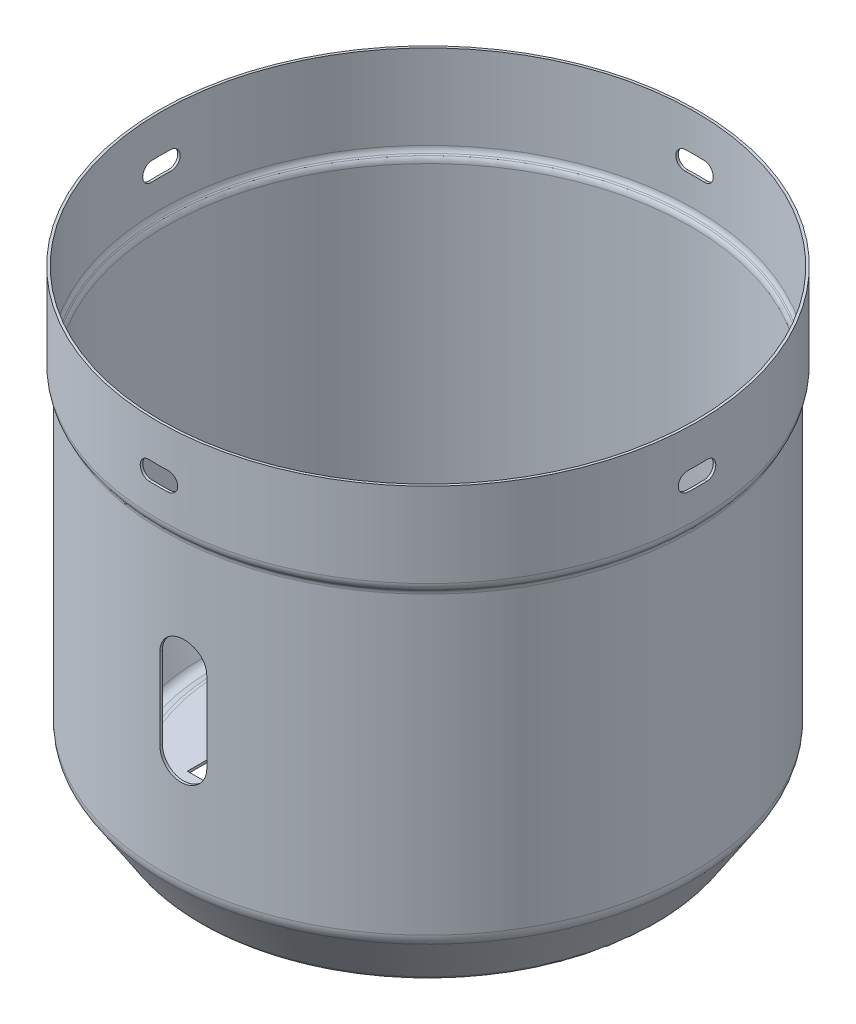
SolidWorks part; units mm, degrees
ref_plane "前视基准面" through (0, 0, 0) normal (0, 0, 1) x (1, 0, 0)
ref_plane "上视基准面" through (0, 0, 0) normal (0, 1, 0) x (1, 0, 0)
ref_plane "右视基准面" through (0, 0, 0) normal (1, 0, 0) x (0, 0, -1)
sketch "草图1" plane through (0, 0, 0) normal (0, 0, 1) x (1, 0, 0)
  line L0 (0, 0) -> (0, 147) construction
  line L1 (0, 2) -> (65.4223, 2)
  line L2 (85.5, 147) -> (85.5, 120)
  line L5 (84.6, 117.8) -> (84.9, 118.2)
  line L6 (84, 116) -> (84, 21.4822)
  line L7 (83.1922, 18.7573) -> (72.3424, 2.0653)
  line L10 (66.5364, 1.7854) -> (68.7129, 0.9148)
  arc A0 (84, 116) -> (84.6, 117.8) centre (87, 116) cw
  arc A1 (85.5, 120) -> (84.9, 118.2) centre (82.5, 120) cw
  arc A2 (83.1922, 18.7573) -> (84, 21.4822) centre (79, 21.4822) ccw
  arc A3 (66.5364, 1.7854) -> (65.4223, 2) centre (65.4223, -1) ccw
  arc A4 (68.7129, 0.9148) -> (72.3424, 2.0653) centre (69.8271, 3.7003) ccw
  point P10 (84, 117)
  point P13 (85.5, 119)
  point P16 (84, 20)
  point P22 (66, 2)
  dimension "D8" = 3
  dimension "D9" = 5
  dimension "D12" = 3
  dimension "D1" = 85.5
  dimension "D2" = 84
  dimension "D3" = 2
  dimension "D4" = 28
  dimension "D5" = 97
  dimension "D11" = 66
revolve "旋转-薄壁1" add sketch "草图1" angle 360 about L0
sketch "草图2" plane through (0, 1.2, 0) normal (0, -1, 0) x (1, 0, 0)
  line L0 (0, 0) -> (65.4223, 0) construction
  line L1 (0, 0) -> (0, 65.4223) construction
  line L2 (16.5, 3.5) -> (16.5, -3.5)
  line L3 (6.5, 3.5) -> (13.5, 3.5)
  line L4 (6.5, 3.5) -> (6.5, -3.5)
  line L5 (6.5, -3.5) -> (13.5, -3.5)
  line L6 (13.5, 3.5) -> (13.5, -3.5)
  line L7 (6.5, 3.5) -> (13.5, -3.5) construction
  line L8 (6.5, -3.5) -> (13.5, 3.5) construction
  line L9 (16.5, 3.5) -> (23.5, 3.5)
  line L10 (23.5, 3.5) -> (23.5, -3.5)
  line L11 (16.5, -3.5) -> (23.5, -3.5)
  line L12 (26.5, 3.5) -> (26.5, -3.5)
  line L13 (26.5, 3.5) -> (33.5, 3.5)
  line L14 (33.5, 3.5) -> (33.5, -3.5)
  line L15 (26.5, -3.5) -> (33.5, -3.5)
  line L16 (36.5, 3.5) -> (36.5, -3.5)
  line L17 (36.5, 3.5) -> (43.5, 3.5)
  line L18 (43.5, 3.5) -> (43.5, -3.5)
  line L19 (36.5, -3.5) -> (43.5, -3.5)
  line L20 (46.5, 3.5) -> (46.5, -3.5)
  line L21 (46.5, 3.5) -> (53.5, 3.5)
  line L22 (53.5, 3.5) -> (53.5, -3.5)
  line L23 (46.5, -3.5) -> (53.5, -3.5)
  line L24 (16.5, 13.5) -> (16.5, 6.5)
  line L25 (16.5, 13.5) -> (23.5, 13.5)
  line L26 (23.5, 13.5) -> (23.5, 6.5)
  line L27 (16.5, 6.5) -> (23.5, 6.5)
  line L28 (26.5, 13.5) -> (26.5, 6.5)
  line L29 (26.5, 13.5) -> (33.5, 13.5)
  line L30 (33.5, 13.5) -> (33.5, 6.5)
  line L31 (26.5, 6.5) -> (33.5, 6.5)
  line L32 (36.5, 13.5) -> (36.5, 6.5)
  line L33 (36.5, 13.5) -> (43.5, 13.5)
  line L34 (43.5, 13.5) -> (43.5, 6.5)
  line L35 (36.5, 6.5) -> (43.5, 6.5)
  line L36 (46.5, 13.5) -> (46.5, 6.5)
  line L37 (46.5, 13.5) -> (53.5, 13.5)
  line L38 (53.5, 13.5) -> (53.5, 6.5)
  line L39 (46.5, 6.5) -> (53.5, 6.5)
  line L40 (16.5, 23.5) -> (16.5, 16.5)
  line L41 (16.5, 23.5) -> (23.5, 23.5)
  line L42 (23.5, 23.5) -> (23.5, 16.5)
  line L43 (16.5, 16.5) -> (23.5, 16.5)
  line L44 (26.5, 23.5) -> (26.5, 16.5)
  line L45 (26.5, 23.5) -> (33.5, 23.5)
  line L46 (33.5, 23.5) -> (33.5, 16.5)
  line L47 (26.5, 16.5) -> (33.5, 16.5)
  line L48 (36.5, 23.5) -> (36.5, 16.5)
  line L49 (36.5, 23.5) -> (43.5, 23.5)
  line L50 (43.5, 23.5) -> (43.5, 16.5)
  line L51 (36.5, 16.5) -> (43.5, 16.5)
  line L56 (16.5, 33.5) -> (16.5, 26.5)
  line L57 (16.5, 33.5) -> (23.5, 33.5)
  line L58 (23.5, 33.5) -> (23.5, 26.5)
  line L59 (16.5, 26.5) -> (23.5, 26.5)
  line L60 (26.5, 33.5) -> (26.5, 26.5)
  line L61 (26.5, 33.5) -> (33.5, 33.5)
  line L62 (33.5, 33.5) -> (33.5, 26.5)
  line L63 (26.5, 26.5) -> (33.5, 26.5)
  line L64 (36.5, 33.5) -> (36.5, 26.5)
  line L65 (36.5, 33.5) -> (43.5, 33.5)
  line L66 (43.5, 33.5) -> (43.5, 26.5)
  line L67 (36.5, 26.5) -> (43.5, 26.5)
  line L72 (16.5, 43.5) -> (16.5, 36.5)
  line L73 (16.5, 43.5) -> (23.5, 43.5)
  line L74 (23.5, 43.5) -> (23.5, 36.5)
  line L75 (16.5, 36.5) -> (23.5, 36.5)
  line L76 (26.5, 43.5) -> (26.5, 36.5)
  line L77 (26.5, 43.5) -> (33.5, 43.5)
  line L78 (33.5, 43.5) -> (33.5, 36.5)
  line L79 (26.5, 36.5) -> (33.5, 36.5)
  line L104 (6.5, 13.5) -> (6.5, 6.5)
  line L105 (6.5, 13.5) -> (13.5, 13.5)
  line L106 (13.5, 13.5) -> (13.5, 6.5)
  line L107 (6.5, 6.5) -> (13.5, 6.5)
  line L108 (6.5, 23.5) -> (6.5, 16.5)
  line L109 (6.5, 23.5) -> (13.5, 23.5)
  line L110 (13.5, 23.5) -> (13.5, 16.5)
  line L111 (6.5, 16.5) -> (13.5, 16.5)
  line L112 (6.5, 33.5) -> (6.5, 26.5)
  line L113 (6.5, 33.5) -> (13.5, 33.5)
  line L114 (13.5, 33.5) -> (13.5, 26.5)
  line L115 (6.5, 26.5) -> (13.5, 26.5)
  line L116 (6.5, 43.5) -> (6.5, 36.5)
  line L117 (6.5, 43.5) -> (13.5, 43.5)
  line L118 (13.5, 43.5) -> (13.5, 36.5)
  line L119 (6.5, 36.5) -> (13.5, 36.5)
  line L120 (6.5, 53.5) -> (6.5, 46.5)
  line L121 (6.5, 53.5) -> (13.5, 53.5)
  line L122 (13.5, 53.5) -> (13.5, 46.5)
  line L123 (6.5, 46.5) -> (13.5, 46.5)
  line L124 (16.5, 53.5) -> (23.5, 53.5)
  line L125 (16.5, 46.5) -> (23.5, 46.5)
  line L126 (16.5, 53.5) -> (16.5, 46.5)
  line L127 (23.5, 53.5) -> (23.5, 46.5)
  line L128 (26.5, 53.5) -> (26.5, 46.5)
  line L129 (33.5, 53.5) -> (33.5, 46.5)
  line L130 (36.5, 53.5) -> (36.5, 46.5)
  line L131 (43.5, 53.5) -> (43.5, 46.5)
  line L132 (46.5, 53.5) -> (46.5, 46.5)
  line L133 (53.5, 53.5) -> (53.5, 46.5)
  line L134 (46.5, 53.5) -> (53.5, 53.5)
  line L135 (46.5, 46.5) -> (53.5, 46.5)
  line L136 (36.5, 46.5) -> (43.5, 46.5)
  line L137 (36.5, 53.5) -> (43.5, 53.5)
  line L138 (26.5, 53.5) -> (33.5, 53.5)
  line L139 (26.5, 46.5) -> (33.5, 46.5)
  line L140 (53.5, 23.5) -> (53.5, 16.5)
  line L141 (46.5, 23.5) -> (46.5, 16.5)
  line L142 (46.5, 23.5) -> (53.5, 23.5)
  line L143 (46.5, 16.5) -> (53.5, 16.5)
  line L144 (46.5, 26.5) -> (53.5, 26.5)
  line L145 (46.5, 33.5) -> (53.5, 33.5)
  line L146 (46.5, 36.5) -> (53.5, 36.5)
  line L147 (53.5, 43.5) -> (53.5, 36.5)
  line L148 (53.5, 33.5) -> (53.5, 26.5)
  line L149 (46.5, 33.5) -> (46.5, 26.5)
  line L150 (46.5, 43.5) -> (53.5, 43.5)
  line L151 (46.5, 43.5) -> (46.5, 36.5)
  line L152 (43.5, 43.5) -> (43.5, 36.5)
  line L153 (36.5, 43.5) -> (36.5, 36.5)
  line L154 (36.5, 43.5) -> (43.5, 43.5)
  line L155 (36.5, 36.5) -> (43.5, 36.5)
  line L156 (53.5, -6.5) -> (53.5, -13.5)
  line L157 (53.5, -6.5) -> (46.5, -6.5)
  line L158 (46.5, -6.5) -> (46.5, -13.5)
  line L159 (53.5, -13.5) -> (46.5, -13.5)
  line L160 (43.5, -6.5) -> (43.5, -13.5)
  line L161 (43.5, -6.5) -> (36.5, -6.5)
  line L162 (36.5, -6.5) -> (36.5, -13.5)
  line L163 (43.5, -13.5) -> (36.5, -13.5)
  line L164 (43.5, -16.5) -> (36.5, -16.5)
  line L165 (43.5, -16.5) -> (43.5, -23.5)
  line L166 (43.5, -23.5) -> (36.5, -23.5)
  line L167 (36.5, -16.5) -> (36.5, -23.5)
  line L168 (43.5, -26.5) -> (36.5, -26.5)
  line L169 (43.5, -26.5) -> (43.5, -33.5)
  line L170 (36.5, -26.5) -> (36.5, -33.5)
  line L171 (43.5, -33.5) -> (36.5, -33.5)
  line L172 (33.5, -6.5) -> (26.5, -6.5)
  line L173 (33.5, -6.5) -> (33.5, -13.5)
  line L174 (33.5, -13.5) -> (26.5, -13.5)
  line L175 (26.5, -6.5) -> (26.5, -13.5)
  line L176 (33.5, -16.5) -> (26.5, -16.5)
  line L177 (33.5, -16.5) -> (33.5, -23.5)
  line L178 (33.5, -23.5) -> (26.5, -23.5)
  line L179 (26.5, -16.5) -> (26.5, -23.5)
  line L180 (33.5, -26.5) -> (26.5, -26.5)
  line L181 (33.5, -26.5) -> (33.5, -33.5)
  line L182 (33.5, -33.5) -> (26.5, -33.5)
  line L183 (26.5, -26.5) -> (26.5, -33.5)
  line L184 (33.5, -36.5) -> (26.5, -36.5)
  line L185 (33.5, -36.5) -> (33.5, -43.5)
  line L186 (26.5, -36.5) -> (26.5, -43.5)
  line L187 (33.5, -43.5) -> (26.5, -43.5)
  line L188 (23.5, -6.5) -> (16.5, -6.5)
  line L189 (23.5, -6.5) -> (23.5, -13.5)
  line L190 (16.5, -6.5) -> (16.5, -13.5)
  line L191 (23.5, -13.5) -> (16.5, -13.5)
  line L192 (23.5, -16.5) -> (16.5, -16.5)
  line L193 (23.5, -16.5) -> (23.5, -23.5)
  line L194 (16.5, -16.5) -> (16.5, -23.5)
  line L195 (23.5, -23.5) -> (16.5, -23.5)
  line L196 (23.5, -26.5) -> (16.5, -26.5)
  line L197 (23.5, -26.5) -> (23.5, -33.5)
  line L198 (23.5, -33.5) -> (16.5, -33.5)
  line L199 (16.5, -26.5) -> (16.5, -33.5)
  line L200 (23.5, -36.5) -> (16.5, -36.5)
  line L201 (23.5, -36.5) -> (23.5, -43.5)
  line L202 (16.5, -36.5) -> (16.5, -43.5)
  line L203 (23.5, -43.5) -> (16.5, -43.5)
  line L204 (13.5, -6.5) -> (6.5, -6.5)
  line L205 (13.5, -6.5) -> (13.5, -13.5)
  line L206 (6.5, -6.5) -> (6.5, -13.5)
  line L207 (13.5, -13.5) -> (6.5, -13.5)
  line L208 (13.5, -16.5) -> (6.5, -16.5)
  line L209 (13.5, -16.5) -> (13.5, -23.5)
  line L210 (6.5, -16.5) -> (6.5, -23.5)
  line L211 (13.5, -23.5) -> (6.5, -23.5)
  line L212 (13.5, -26.5) -> (6.5, -26.5)
  line L213 (13.5, -26.5) -> (13.5, -33.5)
  line L214 (13.5, -33.5) -> (6.5, -33.5)
  line L215 (6.5, -26.5) -> (6.5, -33.5)
  line L216 (13.5, -36.5) -> (6.5, -36.5)
  line L217 (13.5, -36.5) -> (13.5, -43.5)
  line L218 (6.5, -36.5) -> (6.5, -43.5)
  line L219 (13.5, -43.5) -> (6.5, -43.5)
  line L220 (13.5, -46.5) -> (6.5, -46.5)
  line L221 (13.5, -46.5) -> (13.5, -53.5)
  line L222 (6.5, -46.5) -> (6.5, -53.5)
  line L223 (13.5, -53.5) -> (6.5, -53.5)
  line L224 (3.5, -46.5) -> (-3.5, -46.5)
  line L225 (-3.5, -46.5) -> (-3.5, -53.5)
  line L226 (3.5, -53.5) -> (-3.5, -53.5)
  line L227 (3.5, -46.5) -> (3.5, -53.5)
  line L228 (3.5, -36.5) -> (3.5, -43.5)
  line L229 (3.5, -36.5) -> (-3.5, -36.5)
  line L230 (3.5, -43.5) -> (-3.5, -43.5)
  line L231 (-3.5, -36.5) -> (-3.5, -43.5)
  line L232 (3.5, -33.5) -> (-3.5, -33.5)
  line L233 (-3.5, -26.5) -> (-3.5, -33.5)
  line L234 (3.5, -26.5) -> (-3.5, -26.5)
  line L235 (3.5, -26.5) -> (3.5, -33.5)
  line L236 (3.5, -16.5) -> (3.5, -23.5)
  line L237 (3.5, -23.5) -> (-3.5, -23.5)
  line L238 (-3.5, -16.5) -> (-3.5, -23.5)
  line L239 (3.5, -16.5) -> (-3.5, -16.5)
  line L240 (3.5, -13.5) -> (-3.5, -13.5)
  line L241 (3.5, -6.5) -> (3.5, -13.5)
  line L242 (-3.5, -6.5) -> (-3.5, -13.5)
  line L243 (3.5, -6.5) -> (-3.5, -6.5)
  line L244 (-6.5, -53.5) -> (-13.5, -53.5)
  line L245 (-6.5, -53.5) -> (-6.5, -46.5)
  line L246 (-6.5, -46.5) -> (-13.5, -46.5)
  line L247 (-13.5, -53.5) -> (-13.5, -46.5)
  line L248 (-6.5, -43.5) -> (-13.5, -43.5)
  line L249 (-6.5, -43.5) -> (-6.5, -36.5)
  line L250 (-6.5, -36.5) -> (-13.5, -36.5)
  line L251 (-13.5, -43.5) -> (-13.5, -36.5)
  line L252 (-16.5, -43.5) -> (-16.5, -36.5)
  line L253 (-16.5, -43.5) -> (-23.5, -43.5)
  line L254 (-23.5, -43.5) -> (-23.5, -36.5)
  line L255 (-16.5, -36.5) -> (-23.5, -36.5)
  line L256 (-26.5, -43.5) -> (-26.5, -36.5)
  line L257 (-26.5, -43.5) -> (-33.5, -43.5)
  line L258 (-26.5, -36.5) -> (-33.5, -36.5)
  line L259 (-33.5, -43.5) -> (-33.5, -36.5)
  line L260 (-6.5, -33.5) -> (-6.5, -26.5)
  line L261 (-6.5, -33.5) -> (-13.5, -33.5)
  line L262 (-13.5, -33.5) -> (-13.5, -26.5)
  line L263 (-6.5, -26.5) -> (-13.5, -26.5)
  line L264 (-16.5, -33.5) -> (-16.5, -26.5)
  line L265 (-16.5, -33.5) -> (-23.5, -33.5)
  line L266 (-23.5, -33.5) -> (-23.5, -26.5)
  line L267 (-16.5, -26.5) -> (-23.5, -26.5)
  line L268 (-26.5, -33.5) -> (-26.5, -26.5)
  line L269 (-26.5, -33.5) -> (-33.5, -33.5)
  line L270 (-33.5, -33.5) -> (-33.5, -26.5)
  line L271 (-26.5, -26.5) -> (-33.5, -26.5)
  line L272 (-36.5, -33.5) -> (-36.5, -26.5)
  line L273 (-36.5, -33.5) -> (-43.5, -33.5)
  line L274 (-36.5, -26.5) -> (-43.5, -26.5)
  line L275 (-43.5, -33.5) -> (-43.5, -26.5)
  line L276 (-6.5, -23.5) -> (-6.5, -16.5)
  line L277 (-6.5, -23.5) -> (-13.5, -23.5)
  line L278 (-6.5, -16.5) -> (-13.5, -16.5)
  line L279 (-13.5, -23.5) -> (-13.5, -16.5)
  line L280 (-16.5, -23.5) -> (-16.5, -16.5)
  line L281 (-16.5, -23.5) -> (-23.5, -23.5)
  line L282 (-16.5, -16.5) -> (-23.5, -16.5)
  line L283 (-23.5, -23.5) -> (-23.5, -16.5)
  line L284 (-26.5, -23.5) -> (-26.5, -16.5)
  line L285 (-26.5, -23.5) -> (-33.5, -23.5)
  line L286 (-33.5, -23.5) -> (-33.5, -16.5)
  line L287 (-26.5, -16.5) -> (-33.5, -16.5)
  line L288 (-36.5, -23.5) -> (-36.5, -16.5)
  line L289 (-36.5, -23.5) -> (-43.5, -23.5)
  line L290 (-36.5, -16.5) -> (-43.5, -16.5)
  line L291 (-43.5, -23.5) -> (-43.5, -16.5)
  line L292 (-6.5, -13.5) -> (-6.5, -6.5)
  line L293 (-6.5, -13.5) -> (-13.5, -13.5)
  line L294 (-6.5, -6.5) -> (-13.5, -6.5)
  line L295 (-13.5, -13.5) -> (-13.5, -6.5)
  line L296 (-16.5, -13.5) -> (-16.5, -6.5)
  line L297 (-16.5, -13.5) -> (-23.5, -13.5)
  line L298 (-16.5, -6.5) -> (-23.5, -6.5)
  line L299 (-23.5, -13.5) -> (-23.5, -6.5)
  line L300 (-26.5, -13.5) -> (-26.5, -6.5)
  line L301 (-26.5, -13.5) -> (-33.5, -13.5)
  line L302 (-33.5, -13.5) -> (-33.5, -6.5)
  line L303 (-26.5, -6.5) -> (-33.5, -6.5)
  line L304 (-36.5, -13.5) -> (-36.5, -6.5)
  line L305 (-36.5, -13.5) -> (-43.5, -13.5)
  line L306 (-36.5, -6.5) -> (-43.5, -6.5)
  line L307 (-43.5, -13.5) -> (-43.5, -6.5)
  line L308 (-46.5, -13.5) -> (-46.5, -6.5)
  line L309 (-46.5, -13.5) -> (-53.5, -13.5)
  line L310 (-46.5, -6.5) -> (-53.5, -6.5)
  line L311 (-53.5, -13.5) -> (-53.5, -6.5)
  line L312 (-46.5, -3.5) -> (-46.5, 3.5)
  line L313 (-46.5, 3.5) -> (-53.5, 3.5)
  line L314 (-53.5, -3.5) -> (-53.5, 3.5)
  line L315 (-46.5, -3.5) -> (-53.5, -3.5)
  line L316 (-36.5, -3.5) -> (-43.5, -3.5)
  line L317 (-36.5, -3.5) -> (-36.5, 3.5)
  line L318 (-43.5, -3.5) -> (-43.5, 3.5)
  line L319 (-36.5, 3.5) -> (-43.5, 3.5)
  line L320 (-33.5, -3.5) -> (-33.5, 3.5)
  line L321 (-26.5, 3.5) -> (-33.5, 3.5)
  line L322 (-26.5, -3.5) -> (-26.5, 3.5)
  line L323 (-26.5, -3.5) -> (-33.5, -3.5)
  line L324 (-16.5, -3.5) -> (-23.5, -3.5)
  line L325 (-23.5, -3.5) -> (-23.5, 3.5)
  line L326 (-16.5, 3.5) -> (-23.5, 3.5)
  line L327 (-16.5, -3.5) -> (-16.5, 3.5)
  line L328 (-13.5, -3.5) -> (-13.5, 3.5)
  line L329 (-6.5, -3.5) -> (-13.5, -3.5)
  line L330 (-6.5, 3.5) -> (-13.5, 3.5)
  line L331 (-6.5, -3.5) -> (-6.5, 3.5)
  line L332 (-53.5, 6.5) -> (-53.5, 13.5)
  line L333 (-53.5, 6.5) -> (-46.5, 6.5)
  line L334 (-46.5, 6.5) -> (-46.5, 13.5)
  line L335 (-53.5, 13.5) -> (-46.5, 13.5)
  line L336 (-43.5, 6.5) -> (-43.5, 13.5)
  line L337 (-43.5, 6.5) -> (-36.5, 6.5)
  line L338 (-36.5, 6.5) -> (-36.5, 13.5)
  line L339 (-43.5, 13.5) -> (-36.5, 13.5)
  line L340 (-43.5, 16.5) -> (-36.5, 16.5)
  line L341 (-43.5, 16.5) -> (-43.5, 23.5)
  line L342 (-43.5, 23.5) -> (-36.5, 23.5)
  line L343 (-36.5, 16.5) -> (-36.5, 23.5)
  line L344 (-43.5, 26.5) -> (-36.5, 26.5)
  line L345 (-43.5, 26.5) -> (-43.5, 33.5)
  line L346 (-36.5, 26.5) -> (-36.5, 33.5)
  line L347 (-43.5, 33.5) -> (-36.5, 33.5)
  line L348 (-33.5, 6.5) -> (-26.5, 6.5)
  line L349 (-33.5, 6.5) -> (-33.5, 13.5)
  line L350 (-33.5, 13.5) -> (-26.5, 13.5)
  line L351 (-26.5, 6.5) -> (-26.5, 13.5)
  line L352 (-33.5, 16.5) -> (-26.5, 16.5)
  line L353 (-33.5, 16.5) -> (-33.5, 23.5)
  line L354 (-33.5, 23.5) -> (-26.5, 23.5)
  line L355 (-26.5, 16.5) -> (-26.5, 23.5)
  line L356 (-33.5, 26.5) -> (-26.5, 26.5)
  line L357 (-33.5, 26.5) -> (-33.5, 33.5)
  line L358 (-33.5, 33.5) -> (-26.5, 33.5)
  line L359 (-26.5, 26.5) -> (-26.5, 33.5)
  line L360 (-33.5, 36.5) -> (-26.5, 36.5)
  line L361 (-33.5, 36.5) -> (-33.5, 43.5)
  line L362 (-26.5, 36.5) -> (-26.5, 43.5)
  line L363 (-33.5, 43.5) -> (-26.5, 43.5)
  line L364 (-23.5, 6.5) -> (-16.5, 6.5)
  line L365 (-23.5, 6.5) -> (-23.5, 13.5)
  line L366 (-16.5, 6.5) -> (-16.5, 13.5)
  line L367 (-23.5, 13.5) -> (-16.5, 13.5)
  line L368 (-23.5, 16.5) -> (-16.5, 16.5)
  line L369 (-23.5, 16.5) -> (-23.5, 23.5)
  line L370 (-16.5, 16.5) -> (-16.5, 23.5)
  line L371 (-23.5, 23.5) -> (-16.5, 23.5)
  line L372 (-23.5, 26.5) -> (-16.5, 26.5)
  line L373 (-23.5, 26.5) -> (-23.5, 33.5)
  line L374 (-23.5, 33.5) -> (-16.5, 33.5)
  line L375 (-16.5, 26.5) -> (-16.5, 33.5)
  line L376 (-23.5, 36.5) -> (-16.5, 36.5)
  line L377 (-23.5, 36.5) -> (-23.5, 43.5)
  line L378 (-16.5, 36.5) -> (-16.5, 43.5)
  line L379 (-23.5, 43.5) -> (-16.5, 43.5)
  line L380 (-13.5, 6.5) -> (-6.5, 6.5)
  line L381 (-13.5, 6.5) -> (-13.5, 13.5)
  line L382 (-6.5, 6.5) -> (-6.5, 13.5)
  line L383 (-13.5, 13.5) -> (-6.5, 13.5)
  line L384 (-13.5, 16.5) -> (-6.5, 16.5)
  line L385 (-13.5, 16.5) -> (-13.5, 23.5)
  line L386 (-6.5, 16.5) -> (-6.5, 23.5)
  line L387 (-13.5, 23.5) -> (-6.5, 23.5)
  line L388 (-13.5, 26.5) -> (-6.5, 26.5)
  line L389 (-13.5, 26.5) -> (-13.5, 33.5)
  line L390 (-13.5, 33.5) -> (-6.5, 33.5)
  line L391 (-6.5, 26.5) -> (-6.5, 33.5)
  line L392 (-13.5, 36.5) -> (-6.5, 36.5)
  line L393 (-13.5, 36.5) -> (-13.5, 43.5)
  line L394 (-6.5, 36.5) -> (-6.5, 43.5)
  line L395 (-13.5, 43.5) -> (-6.5, 43.5)
  line L396 (-13.5, 46.5) -> (-6.5, 46.5)
  line L397 (-13.5, 46.5) -> (-13.5, 53.5)
  line L398 (-6.5, 46.5) -> (-6.5, 53.5)
  line L399 (-13.5, 53.5) -> (-6.5, 53.5)
  line L400 (-3.5, 46.5) -> (3.5, 46.5)
  line L401 (3.5, 46.5) -> (3.5, 53.5)
  line L402 (-3.5, 53.5) -> (3.5, 53.5)
  line L403 (-3.5, 46.5) -> (-3.5, 53.5)
  line L404 (-3.5, 36.5) -> (-3.5, 43.5)
  line L405 (-3.5, 36.5) -> (3.5, 36.5)
  line L406 (-3.5, 43.5) -> (3.5, 43.5)
  line L407 (3.5, 36.5) -> (3.5, 43.5)
  line L408 (-3.5, 33.5) -> (3.5, 33.5)
  line L409 (3.5, 26.5) -> (3.5, 33.5)
  line L410 (-3.5, 26.5) -> (3.5, 26.5)
  line L411 (-3.5, 26.5) -> (-3.5, 33.5)
  line L412 (-3.5, 16.5) -> (-3.5, 23.5)
  line L413 (-3.5, 23.5) -> (3.5, 23.5)
  line L414 (3.5, 16.5) -> (3.5, 23.5)
  line L415 (-3.5, 16.5) -> (3.5, 16.5)
  line L416 (-3.5, 13.5) -> (3.5, 13.5)
  line L417 (-3.5, 6.5) -> (-3.5, 13.5)
  line L418 (3.5, 6.5) -> (3.5, 13.5)
  line L419 (-3.5, 6.5) -> (3.5, 6.5)
  circle A0 centre (0, 0) radius 65.4223 construction
  circle A1 centre (0, 0) radius 3.5
  point P7 (10, 0)
  point P428 (0, 0)
  dimension "D1" = 7
  dimension "D2" = 3.5
  dimension "D3" = 6.5
  dimension "D4" = 5
  dimension "D5" = 6
  dimension "D6" = 4
extrude "切除-拉伸1" cut sketch "草图2" against normal blind 10
sketch "草图3" plane through (0, 0, 0) normal (0, 0, 1) x (1, 0, 0)
  line L0 (0, 147) -> (0, 116) construction
  line L1 (85.5, 147) -> (-85.5, 147) construction
  line L2 (84.8, 116) -> (-84.8, 116) construction
  line L3 (-3, 132) -> (3, 132) construction
  line L4 (-3, 135) -> (3, 135)
  line L5 (-3, 129) -> (3, 129)
  arc A0 (-3, 135) -> (-3, 129) centre (-3, 132) ccw
  arc A1 (3, 129) -> (3, 135) centre (3, 132) ccw
  point P8 (0, 132)
  point P13 (-6, 132)
  point P14 (6, 132)
  dimension "D1" = 6
  dimension "D2" = 12
  dimension "D3" = 15
extrude "切除-拉伸2" cut sketch "草图3" against normal blind 10 from offset 85
pattern_circular "阵列(圆周)1" count 4 over 360 about axis through (0, 0, 0) along (0, -1, 0) of "切除-拉伸2"
sketch "草图4" plane through (0, 0, 0) normal (0, 0, 1) x (1, 0, 0)
  line L0 (0, 147) -> (0, 0) construction
  line L1 (85.5, 147) -> (-85.5, 147) construction
  line L2 (6, 82) -> (6, 56) construction
  line L3 (13, 82) -> (13, 56)
  line L4 (-1, 82) -> (-1, 56)
  arc A0 (13, 82) -> (-1, 82) centre (6, 82) ccw
  arc A1 (-1, 56) -> (13, 56) centre (6, 56) ccw
  point P7 (6, 69)
  dimension "D1" = 65
  dimension "D2" = 14
  dimension "D3" = 26
  dimension "D4" = 6
extrude "切除-拉伸3" cut sketch "草图4" against normal blind 10 from offset 86
